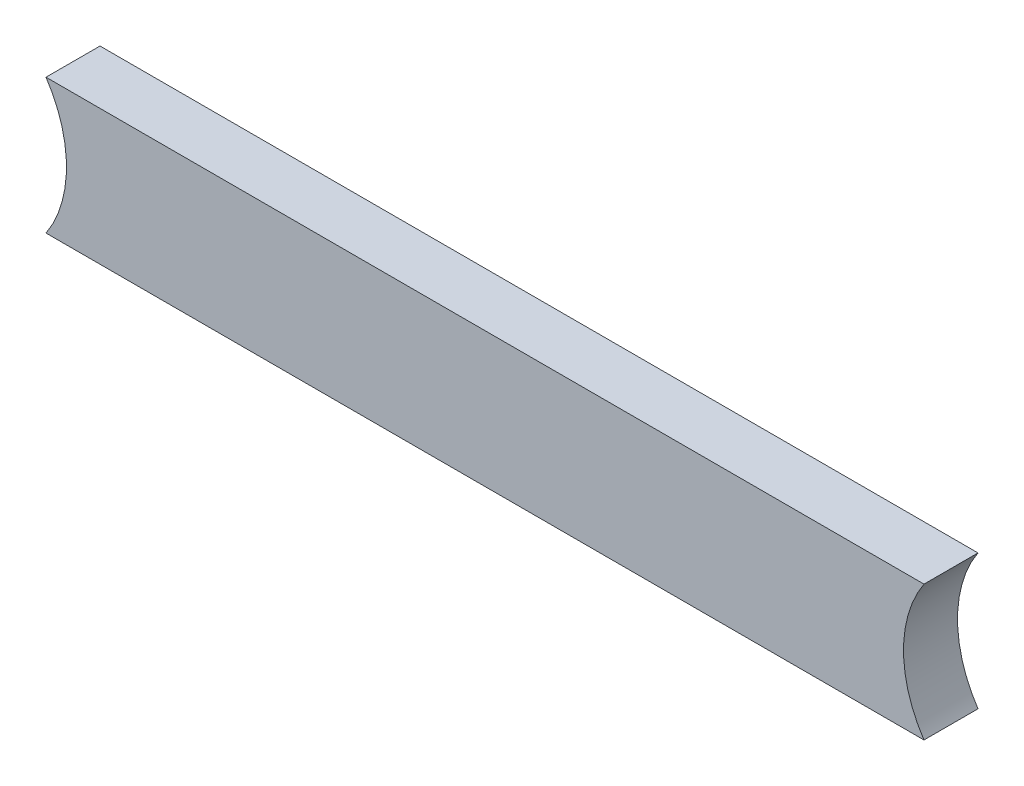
SolidWorks part; units mm, degrees
ref_plane "Plan de face" through (0, 0, 0) normal (0, 0, 1) x (1, 0, 0)
ref_plane "Plan de dessus" through (0, 0, 0) normal (0, 1, 0) x (1, 0, 0)
ref_plane "Plan de droite" through (0, 0, 0) normal (1, 0, 0) x (0, 0, -1)
sketch "Esquisse1" plane through (0, 0, 0) normal (0, 0, 1) x (1, 0, 0)
  line L0 (-81.2917, 12.5) -> (81.2917, 12.5)
  line L1 (-81.2917, -12.5) -> (81.2917, -12.5)
  line L2 (0.1054, 35.9155) -> (0.1054, -45.999) construction
  arc A0 (-81.2917, 12.5) -> (-81.2917, -12.5) centre (-100, 0) cw
  arc A1 (81.2917, 12.5) -> (81.2917, -12.5) centre (100, 0) ccw
  dimension "D1" = 22.5
  dimension "D2" = 22.5
  dimension "D3" = 12.5
  dimension "D4" = 25
  dimension "D5" = 200
  dimension "D6" = 100
extrude "Boss.-Extru.1" add sketch "Esquisse1" along normal blind 10
